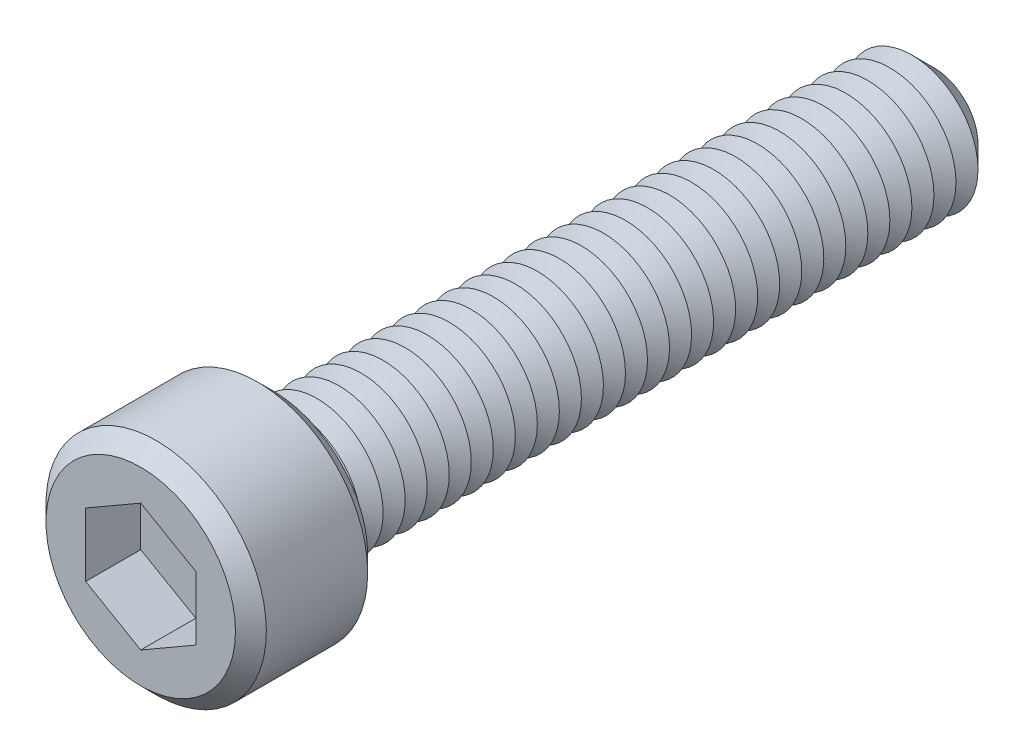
SolidWorks part; units mm, degrees
ref_plane "Front Plane" through (0, 0, 0) normal (0, 0, 1) x (1, 0, 0)
ref_plane "Top Plane" through (0, 0, 0) normal (0, 1, 0) x (1, 0, 0)
ref_plane "Right Plane" through (0, 0, 0) normal (1, 0, 0) x (0, 0, -1)
sketch "Sketch1" plane through (0, 0, 0) normal (0, 0, 1) x (1, 0, 0)
  circle A0 centre (0, 0) radius 5
  dimension "D1" = 10
extrude "Boss-Extrude1" add sketch "Sketch1" along normal blind 6
sketch "Sketch2" plane through (0, 0, 0) normal (0, 0, -1) x (-1, 0, 0)
  circle A0 centre (0, 0) radius 3
  dimension "D1" = 6
extrude "Boss-Extrude2" add sketch "Sketch2" along normal blind 30
chamfer "Chamfer1" distance 1 angle 45 1 edges at (-3, 0, -30)
sketch "Sketch3" plane through (0, 0, 0) normal (1, 0, 0) x (0, 0, -1)
  line L0 (-2.5121, 0) -> (4.5776, 0) construction
sketch "Sketch4" plane through (0, 0, 0) normal (1, 0, 0) x (0, 0, -1)
  line L0 (0, 3) -> (0.5, 2.134)
  line L1 (0.5, 2.134) -> (1, 3)
  line L2 (29, 3) -> (0, 3) construction
  line L3 (1, 3) -> (0, 3)
  dimension "D1" = 1
revolve "Cut-Revolve1" cut sketch "Sketch4" angle 360 about L0
pattern_linear "LPattern1" count 29 spacing 1 along (0, 0, -1) of "Cut-Revolve1"
sketch "Sketch5" plane through (0, 0, 6) normal (0, 0, 1) x (1, 0, 0)
  line L1 (0, 2.8868) -> (-2.5, 1.4434)
  line L2 (-2.5, 1.4434) -> (-2.5, -1.4434)
  line L3 (-2.5, -1.4434) -> (0, -2.8868)
  line L4 (0, -2.8868) -> (2.5, -1.4434)
  line L5 (2.5, -1.4434) -> (2.5, 1.4434)
  line L6 (2.5, 1.4434) -> (0, 2.8868)
  circle A0 centre (0, 0) radius 2.5 construction
  dimension "D1" = 5
extrude "Cut-Extrude1" cut sketch "Sketch5" against normal blind 2.5
sketch "Sketch6" plane through (0, 0, 3.5) normal (0, 0, 1) x (1, 0, 0)
  circle A0 centre (0, 0) radius 0.8
  dimension "D1" = 1.6
extrude "Cut-Extrude2" cut sketch "Sketch6" against normal up to surface (33.5 mm away)
chamfer "Chamfer2" distance 0.7 angle 45 2 edges at (5, 0, 0) (5, 0, 6)
